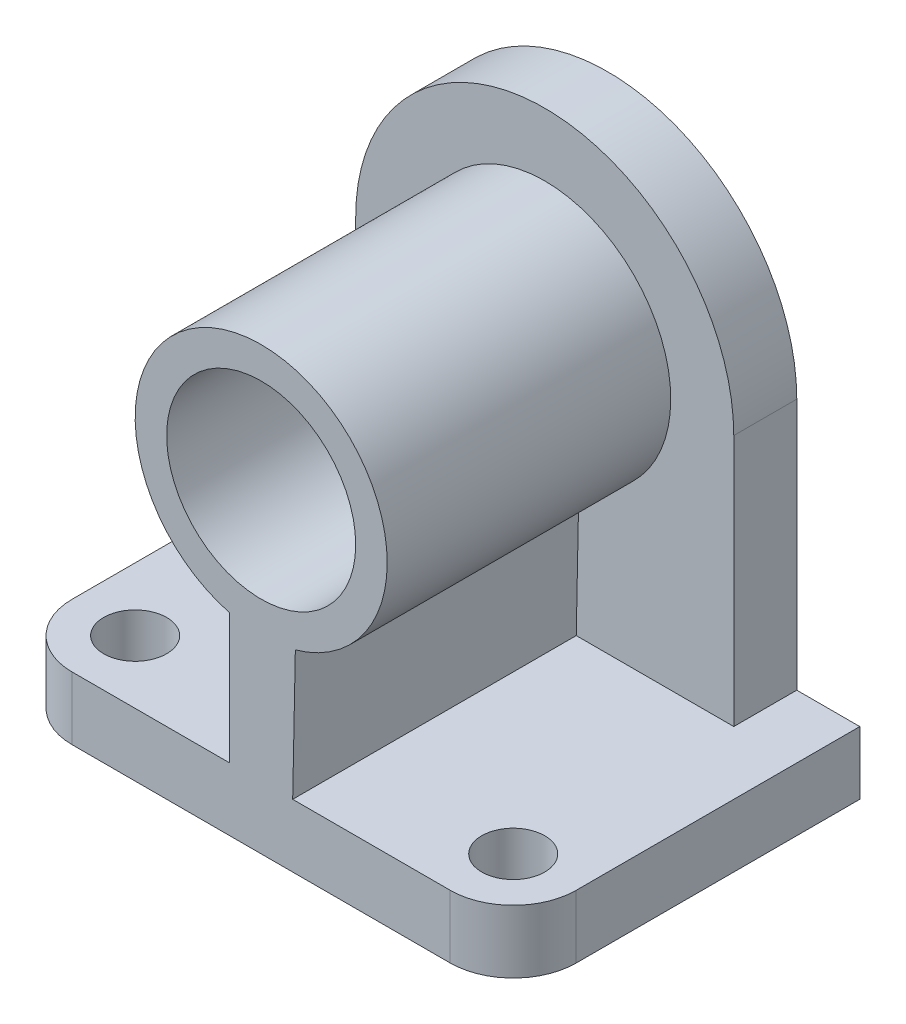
SolidWorks part; units mm, degrees
ref_plane "前视基准面" through (0, 0, 0) normal (0, 0, 1) x (1, 0, 0)
ref_plane "上视基准面" through (0, 0, 0) normal (0, 1, 0) x (1, 0, 0)
ref_plane "右视基准面" through (0, 0, 0) normal (1, 0, 0) x (0, 0, -1)
sketch "草图1" plane through (0, 0, 0) normal (0, 1, 0) x (1, 0, 0)
  line L0 (0, 0) -> (0, -69.2948) construction
  line L1 (40, 0) -> (-40, 0)
  line L2 (-40, 0) -> (-40, -45)
  line L3 (-30, -55) -> (30, -55)
  line L4 (40, 0) -> (40, -45)
  arc A0 (-30, -55) -> (-40, -45) centre (-30, -45) cw
  circle A1 centre (-30, -45) radius 5
  arc A2 (30, -55) -> (40, -45) centre (30, -45) ccw
  circle A3 centre (30, -45) radius 5
  point P9 (-40, -55)
  point P15 (0, -55)
  point P16 (0, 0)
  dimension "D3" = 10
  dimension "D4" = 10
  dimension "D1" = 40
  dimension "D2" = 55
extrude "凸台-拉伸1" add sketch "草图1" along normal blind 10
sketch "草图2" plane through (0, 0, 0) normal (0, 0, 1) x (1, 0, 0)
  line L0 (0, -5.3852) -> (0, 86.7374) construction
  line L1 (-43.2807, 50) -> (43.2807, 50) construction
  line L2 (-30, 50) -> (-30, 10)
  line L3 (-30, 10) -> (30, 10)
  line L4 (30, 10) -> (30, 50)
  arc A0 (-30, 50) -> (30, 50) centre (0, 50) cw
  circle A1 centre (0, 50) radius 15
  dimension "D2" = 30
  dimension "D3" = 30
  dimension "D1" = 40
extrude "凸台-拉伸2" add sketch "草图2" along normal blind 10
sketch "草图3" plane through (0, 0, 10) normal (0, 0, 1) x (1, 0, 0)
  line L0 (0, 73.0549) -> (0, 5.8978) construction
  line L1 (-5, 30.6351) -> (-5, 10)
  line L2 (-30, 10) -> (30, 10) construction
  line L3 (-5, 10) -> (5, 10)
  line L5 (5.4205, 30.7485) -> (5, 10)
  arc A0 (5.4205, 30.7485) -> (-5, 30.6351) centre (0, 50) ccw
  circle A1 centre (0, 50) radius 15
  dimension "D1" = 40
  dimension "D2" = 30
  dimension "D3" = 5
extrude "凸台-拉伸3" add sketch "草图3" along normal blind 45
